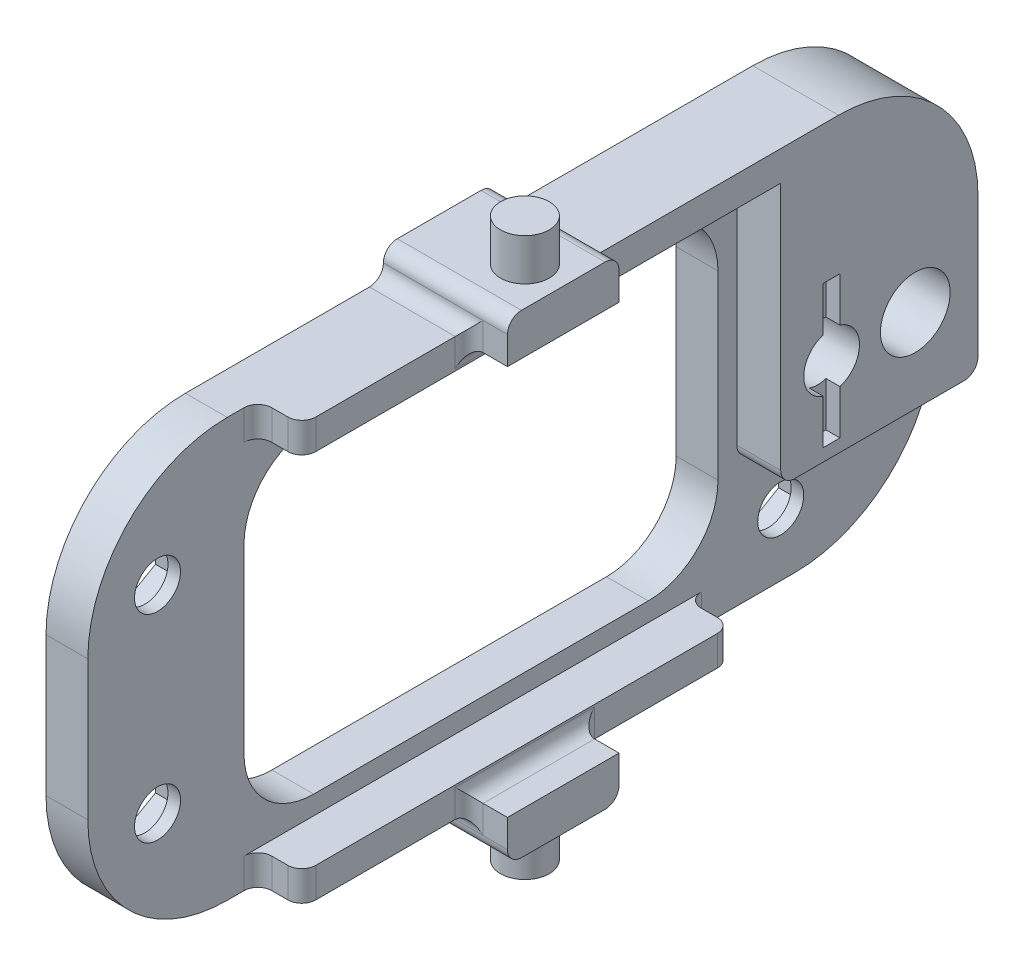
SolidWorks part; units mm, degrees
ref_plane "Front Plane" through (0, 0, 0) normal (1, 0, 0) x (0, 1, 0)
ref_plane "Top Plane" through (0, 0, 0) normal (0, 0, 1) x (0, 1, 0)
ref_plane "Right Plane" through (0, 0, 0) normal (0, 1, 0) x (-1, 0, 0)
sketch "Sketch1" plane through (0, 0, 0) normal (1, 0, 0) x (0, 1, 0)
  line L0 (-15, 28.2) -> (-15, 4)
  line L1 (-15, -32.5) -> (15, -32.5)
  line L2 (15, -32.5) -> (15, -4)
  line L3 (-15, 28.2) -> (15, 28.2)
  line L4 (-7.1, 23.2) -> (7.1, 23.2) construction
  line L7 (15, 4) -> (17, 4)
  line L8 (17, 4) -> (17, -4)
  line L9 (17, -4) -> (15, -4)
  line L10 (15, 4) -> (15, 28.2)
  line L11 (-17, -4) -> (-15, -4)
  line L12 (-17, 4) -> (-17, -4)
  line L13 (-15, 4) -> (-17, 4)
  line L14 (-15, -4) -> (-15, -32.5)
  line L16 (11.5, -17) -> (-11.5, -17)
  line L17 (11.5, -17) -> (11.5, 17)
  line L18 (11.5, 17) -> (-11.5, 17)
  line L19 (-11.5, -17) -> (-11.5, 17)
  line L20 (11.5, -17) -> (-11.5, 17) construction
  line L21 (11.5, 17) -> (-11.5, -17) construction
  circle A1 centre (0, -22) radius 2
  circle A2 centre (0, -28) radius 2.5
  circle A3 centre (-7.1, 23.2) radius 1.65
  circle A4 centre (7.1, 23.2) radius 1.65
  circle A5 centre (-10.5, -21.5) radius 1.65
  point P0 (0, 0)
  point P8 (0, 28.2)
  point P17 (17, 0)
  point P26 (-17, 0)
  point P31 (0, 23.2)
  point P32 (0, 17)
  dimension "D6" = 4
  dimension "D7" = 5
  dimension "D4" = 3.3
  dimension "D2" = 23
  dimension "D3" = 15
  dimension "D5" = 4.5
  dimension "D8" = 34
  dimension "D9" = 14.2
  dimension "D10" = 8
  dimension "D11" = 2
  dimension "D12" = 5
  dimension "D13" = 11.2
  dimension "D14" = 5
  dimension "D15" = 6
  dimension "D16" = 4.5
  dimension "D17" = 1
extrude "Boss-Extrude1" add sketch "Sketch1" along normal blind 3
sketch "Sketch2" plane through (3, 0, 0) normal (1, 0, 0) x (0, 1, 0)
  line L5 (15, 4) -> (17, 4)
  line L6 (17, 4) -> (17, -4)
  line L7 (17, -4) -> (15, -4)
  line L8 (15, -4) -> (15, -32.5)
  line L14 (15, 16) -> (15, 4)
  line L16 (-15, 16) -> (-15, 4)
  line L17 (-15, 4) -> (-17, 4)
  line L18 (-17, 4) -> (-17, -4)
  line L19 (-17, -4) -> (-15, -4)
  line L20 (-15, -4) -> (-15, -14.8)
  line L21 (-6, -32.5) -> (15, -32.5)
  line L22 (15, 4) -> (15, 28.2) construction
  line L23 (-15, 28.2) -> (-15, 4) construction
  line L24 (-5, -22) -> (5, -22) construction
  line L26 (-12.85, 16) -> (-12.85, -14.8)
  line L27 (-6, -18.35) -> (12.85, -18.35)
  line L28 (12.85, 16) -> (12.85, -18.35)
  line L29 (-13.5, -21.5) -> (-7.5, -21.5) construction
  line L30 (-6, -18.35) -> (-6, -32.5)
  line L31 (-15, -14.8) -> (-12.85, -14.8)
  line L32 (11.5, -17) -> (12.85, -17) construction
  line L33 (11.5, -17) -> (11.5, -18.35) construction
  line L34 (15, 16) -> (12.85, 16)
  line L35 (-15, 16) -> (-12.85, 16)
  line L36 (-11.5, -17) -> (-12.85, -17) construction
  circle A1 centre (0, -22) radius 2
  circle A2 centre (0, -28) radius 2.5
  circle A3 centre (0, -22) radius 2 construction
  circle A4 centre (0, -28) radius 2.5 construction
  circle A5 centre (-10.5, -21.5) radius 1.65 construction
  point P4 (0, 0)
  point P40 (0, -22)
  point P56 (-10.5, -21.5)
  point P62 (-13.925, -14.8)
  dimension "D1" = 1.35
  dimension "D2" = 12
  dimension "D3" = 10
  dimension "D4" = 6
  dimension "D5" = 1
  dimension "D6" = 10.8
extrude "Boss-Extrude2" add sketch "Sketch2" along normal blind 3.15
sketch "Sketch3" plane through (6.15, 0, 0) normal (1, 0, 0) x (0, 1, 0)
  line L0 (17, -4) -> (17, 4)
  line L1 (17, 4) -> (14, 4)
  line L2 (14, 4) -> (14, -4)
  line L3 (14, -4) -> (17, -4)
  line L4 (0, 0) -> (0, 15) construction
  line L6 (-14, -4) -> (-17, -4)
  line L7 (-14, 4) -> (-14, -4)
  line L8 (-17, -4) -> (-17, 4)
  line L9 (-17, 4) -> (-14, 4)
  point P15 (-17, 0)
  point P16 (-14, 0)
  point P17 (17, 0)
  dimension "D1" = 3
extrude "Boss-Extrude3" add sketch "Sketch3" along normal blind 2.75
sketch "Sketch8" plane through (0, -17, 0) normal (0, -1, 0) x (1, 0, 0)
  line L0 (6.15, 16) -> (6.15, 4) construction
  circle A0 centre (6.15, 0) radius 1.75
  dimension "D1" = 3.5
extrude "Boss-Extrude5" add sketch "Sketch8" along normal blind 3
mirror "Mirror2" about plane through (0, 0, 0) normal (0, 1, 0) of "Boss-Extrude5"
sketch "Sketch9" plane through (6.15, 0, 0) normal (1, 0, 0) x (0, 1, 0)
  line L0 (-5.1, -22) -> (5.1, -22) construction
  line L1 (-6, -32.5) -> (15, -32.5) construction
  line L2 (-5.1, -21.4) -> (5.1, -21.4)
  line L3 (-5.1, -21.4) -> (-5.1, -22.6)
  line L4 (-5.1, -22.6) -> (5.1, -22.6)
  line L5 (5.1, -21.4) -> (5.1, -22.6)
  circle A0 centre (0, -22) radius 2 construction
  point P4 (0, -22)
  point P9 (-5.1, -22)
  point P10 (0, -21.4)
  dimension "D1" = 1.2
  dimension "D2" = 10.2
extrude "Cut-Extrude2" cut sketch "Sketch9" against normal blind 1
sketch "Sketch11" plane through (0, 0, 0) normal (-1, 0, 0) x (0, -1, 0)
  line L0 (-15, 28.2) -> (15, 28.2) construction
  line L1 (-5.4546, 26.05) -> (-8.7454, 26.05)
  line L2 (-8.7454, 26.05) -> (-10.3909, 23.2)
  line L3 (-10.3909, 23.2) -> (-8.7454, 20.35)
  line L4 (-8.7454, 20.35) -> (-5.4546, 20.35)
  line L5 (-5.4546, 20.35) -> (-3.8091, 23.2)
  line L6 (-3.8091, 23.2) -> (-5.4546, 26.05)
  line L7 (8.7454, 26.05) -> (5.4546, 26.05)
  line L8 (5.4546, 26.05) -> (3.8091, 23.2)
  line L9 (3.8091, 23.2) -> (5.4546, 20.35)
  line L10 (5.4546, 20.35) -> (8.7454, 20.35)
  line L11 (8.7454, 20.35) -> (10.3909, 23.2)
  line L12 (10.3909, 23.2) -> (8.7454, 26.05)
  line L13 (11.5, -17) -> (-11.5, -17) construction
  line L14 (8.8546, -18.65) -> (7.2091, -21.5)
  line L15 (7.2091, -21.5) -> (8.8546, -24.35)
  line L16 (8.8546, -24.35) -> (12.1454, -24.35)
  line L17 (12.1454, -24.35) -> (13.7909, -21.5)
  line L18 (13.7909, -21.5) -> (12.1454, -18.65)
  line L19 (12.1454, -18.65) -> (8.8546, -18.65)
  circle A0 centre (-7.1, 23.2) radius 2.85 construction
  circle A1 centre (7.1, 23.2) radius 2.85 construction
  circle A2 centre (10.5, -21.5) radius 2.85 construction
  dimension "D1" = 5.7
extrude "Cut-Extrude3" cut sketch "Sketch11" against normal blind 2.1
fillet "Fillet2" radius 10 4 edges at (3.075, 15, -32.5) (1.5, -15, -32.5) (1.5, -15, 28.2) (1.5, 15, 28.2)
fillet "Fillet3" radius 1 22 edges at (4.45, 17, 4) (3.075, 15, 4) (4.45, 17, -4) (3.075, 15, -4) (3.075, -15, -4) (4.45, -17, -4) (4.45, -17, 4) (3.075, -15, 4) (6.15, 14.5, 4) (6.15, 14.5, -4) (6.15, -14.5, -4) (6.15, -14.5, 4) (6.15, -14, 0) (6.15, 14, 0) (6.15, 13.925, 16) (6.15, -13.925, 16) (3, -13.925, 16) (3, 13.925, 16) (4.575, -6, -32.4499) (6.15, -13.925, -14.8) (3, -13.925, -14.8) (4.575, -6, -18.35)
fillet "Fillet4" radius 5 4 edges at (1.5, 11.5, -17) (1.5, -11.5, -17) (1.5, 11.5, 17) (1.5, -11.5, 17)
sketch "Sketch10" plane through (0, 0, 0) normal (-1, 0, 0) x (0, -1, 0)
  circle A0 centre (0, -28) radius 3.5
  circle A1 centre (0, -28) radius 2.5 construction
  dimension "D1" = 1
